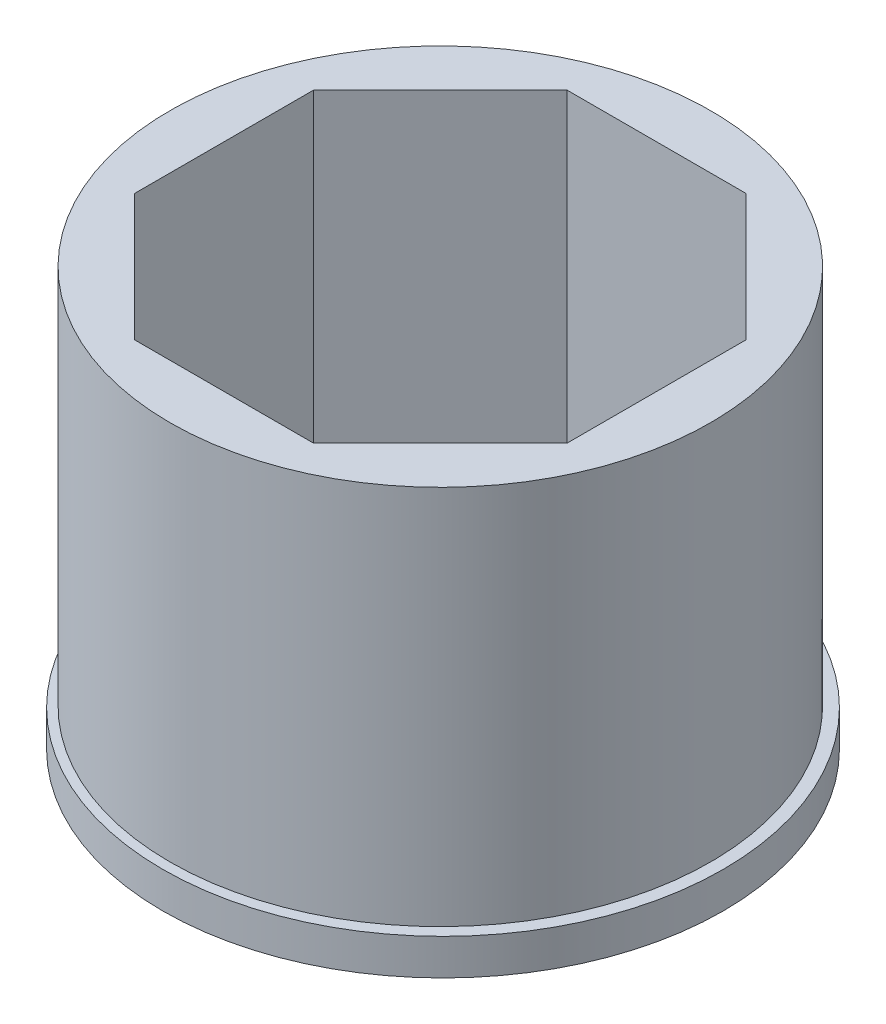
SolidWorks part; units mm, degrees
ref_plane "Front Plane" through (0, 0, 0) normal (0, 0, 1) x (1, 0, 0)
ref_plane "Top Plane" through (0, 0, 0) normal (0, 1, 0) x (1, 0, 0)
ref_plane "Right Plane" through (0, 0, 0) normal (1, 0, 0) x (0, 0, -1)
sketch "Sketch1" plane through (0, 0, 0) normal (0, 1, 0) x (1, 0, 0)
  circle A0 centre (0, 0) radius 6.75
  dimension "D1" = 13.5
extrude "Boss-Extrude1" add sketch "Sketch1" along normal blind 9.5
sketch "Sketch3" plane through (0, 0, 0) normal (0, 1, 0) x (1, 0, 0)
  circle A0 centre (0.0674, 0) radius 7
  dimension "D1" = 14
extrude "Boss-Extrude2" add sketch "Sketch3" against normal blind 0.9
sketch "Sketch2" plane through (0, 0, 0) normal (0, -1, 0) x (1, 0, 0)
  line L0 (5.4, 2.2368) -> (2.2368, 5.4)
  line L7 (-2.2368, 5.4) -> (-5.4, 2.2368)
  line L8 (-5.4, 2.2368) -> (-5.4, -2.2368)
  line L9 (-5.4, -2.2368) -> (-2.2368, -5.4)
  line L10 (-2.2368, -5.4) -> (2.2368, -5.4)
  line L11 (2.2368, -5.4) -> (5.4, -2.2368)
  line L12 (5.4, -2.2368) -> (5.4, 2.2368)
  line L13 (2.2368, 5.4) -> (-2.2368, 5.4)
  line L14 (0, -7.9132) -> (0, 6.9417) construction
  circle A1 centre (0, 0) radius 5.4 construction
  dimension "D1" = 10.8
extrude "Cut-Extrude1" cut sketch "Sketch2" against normal blind 15 and the other way blind 15
